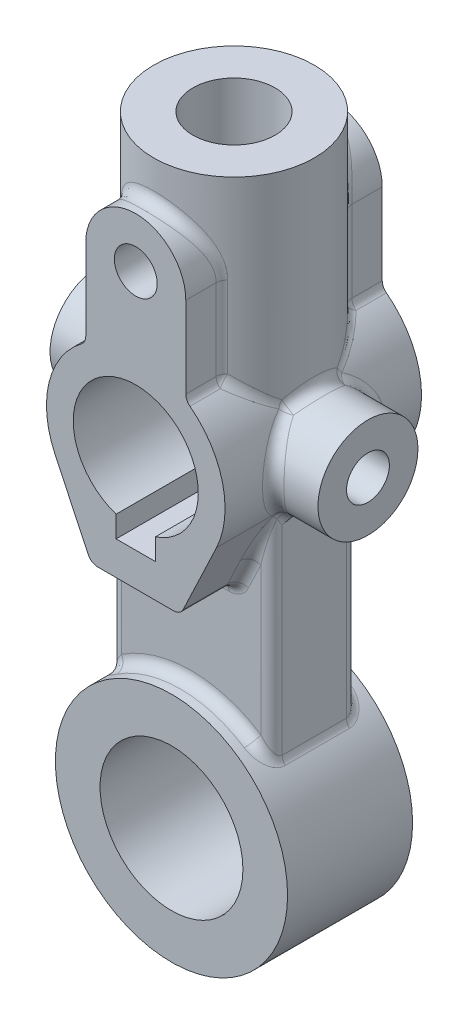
SolidWorks part; units mm, degrees
ref_plane "Front Plane" through (0, 0, 0) normal (0, 0, 1) x (1, 0, 0)
ref_plane "Top Plane" through (0, 0, 0) normal (0, 1, 0) x (1, 0, 0)
ref_plane "Right Plane" through (0, 0, 0) normal (1, 0, 0) x (0, 0, -1)
sketch "Sketch1" plane through (0, 0, 0) normal (0, 0, 1) x (1, 0, 0)
  line L0 (0, 0) -> (0, -32) construction
  line L1 (-12.5, -32) -> (12.5, -32)
  line L2 (12.5, -32) -> (22.5914, -10.7065)
  line L3 (-12.5, -32) -> (-22.5914, -10.7065)
  line L4 (14, 45) -> (14, 20.7123)
  line L5 (-14, 45) -> (-14, 20.7123)
  arc A0 (-14, 20.7123) -> (-22.5914, -10.7065) centre (0, 0) ccw
  arc A1 (-14, 45) -> (14, 45) centre (0, 45) cw
  arc A2 (22.5914, -10.7065) -> (14, 20.7123) centre (0, 0) ccw
  dimension "D1" = 14
  dimension "D3" = 25
  dimension "D4" = 45
  dimension "D2" = 25
  dimension "D5" = 32
extrude "Extrude1" add sketch "Sketch1" along normal mid plane 55
sketch "Sketch2" plane through (0, 0, 0) normal (0, 1, 0) x (1, 0, 0)
  circle A0 centre (0, 0) radius 22.5
  dimension "D1" = 45
extrude "Extrude2" add sketch "Sketch2" along normal blind 70
sketch "Sketch3" plane through (0, 0, 0) normal (0, 1, 0) x (1, 0, 0)
  line L0 (22.5, 12) -> (-22.5, -12) construction
  line L1 (-22.5, 12) -> (22.5, 12)
  line L2 (-22.5, 12) -> (-22.5, -12)
  line L3 (-22.5, -12) -> (22.5, -12)
  line L4 (22.5, 12) -> (22.5, -12)
  circle A0 centre (0, 0) radius 22.5 construction
  dimension "D1" = 24
extrude "Extrude3" add sketch "Sketch3" against normal blind 95
sketch "Sketch4" plane through (0, 0, 0) normal (0, 0, 1) x (1, 0, 0)
  line L0 (-22.5, -95) -> (22.5, -95) construction
  circle A0 centre (0, -95) radius 32.5
  dimension "D1" = 65
extrude "Extrude4" add sketch "Sketch4" along normal mid plane 35
sketch "Sketch5" plane through (0, 0, 0) normal (1, 0, 0) x (0, 0, -1)
  circle A0 centre (0, 0) radius 14
  dimension "D1" = 28
extrude "Extrude5" add sketch "Sketch5" along normal mid plane 75
sketch "Sketch6" plane through (0, 0, 0) normal (0, 0, 1) x (1, 0, 0)
  line L0 (0, 0) -> (0, -22.6132) construction
  line L1 (-5.5, -22.6132) -> (5.5, -22.6132)
  line L2 (5.5, -22.6132) -> (5.5, -16.6132)
  line L3 (-5.5, -22.6132) -> (-5.5, -16.6132)
  arc A0 (5.5, -16.6132) -> (-5.5, -16.6132) centre (0, 0) ccw
  dimension "D1" = 35
  dimension "D2" = 11
  dimension "D3" = 6
extrude "Cut-Extrude1" cut sketch "Sketch6" against normal through all and the other way through all
sketch "Sketch7" plane through (0, 0, 0) normal (0, 0, 1) x (1, 0, 0)
  circle A0 centre (0, 45) radius 6
  dimension "D1" = 12
extrude "Cut-Extrude2" cut sketch "Sketch7" against normal through all and the other way through all
sketch "Sketch8" plane through (0, 0, 0) normal (1, 0, 0) x (0, 0, -1)
  circle A0 centre (0, 0) radius 6
  dimension "D1" = 12
extrude "Cut-Extrude3" cut sketch "Sketch8" against normal through all and the other way through all
sketch "Sketch9" plane through (0, 70, 0) normal (0, 1, 0) x (-1, 0, 0)
  circle A0 centre (0, 0) radius 11.5
  dimension "D1" = 23
extrude "Cut-Extrude4" cut sketch "Sketch9" against normal blind 70
sketch "Sketch10" plane through (0, 0, 0) normal (0, 0, 1) x (1, 0, 0)
  circle A0 centre (0, -95) radius 20
  dimension "D1" = 40
extrude "Cut-Extrude5" cut sketch "Sketch10" against normal through all and the other way through all
fillet "Fillet1" radius 3 8 edges at (12.5, -32, 19.75) (-12.5, -32, 19.75) (-12.5, -32, -19.75) (12.5, -32, -19.75) (-22.5, -41.2236, -12) (22.5, -41.2236, -12) (22.5, -41.2236, 12) (-22.5, -41.2236, 12)
fillet "Fillet2" radius 3 4 edges at (-14, 20.7123, 22.557) (-14, 20.7123, -22.557) (14, 20.7123, 22.557) (14, 20.7123, -22.557)
fillet "Fillet3" radius 3 36 edges at (14.156, 21.2938, -17.4888) (14, 33.6243, -17.6139) (-14.4347, 20.6932, -17.2595) (-14, 33.6243, -17.6139) (-14.156, 21.2938, 17.4888) (-14, 33.6243, 17.6139) (14.4347, 20.6932, 17.2595) (14, 33.6243, 17.6139) (21.6213, -12.7534, -11.1213) (16.4064, -23.7572, -12) (12.2059, -31.5352, -12) (-21.6213, -12.7534, -11.1213) (-16.4064, -23.7572, -12) (-12.2059, -31.5352, -12) (-21.6213, -12.7534, 11.1213) (-16.4064, -23.7572, 12) (-12.2059, -31.5352, 12) (21.6213, -12.7534, 11.1213) (16.4064, -23.7572, 12) (12.2059, -31.5352, 12) (-21.741, -70.8426, 10.9945) (-22.5, -71.5479, 0) (-22.0944, -71.1654, -10.5064) (0, -62.5, -12) (21.741, -70.8426, -10.9945) (22.5, -71.5479, 0) (22.0944, -71.1654, 10.5064) (0.5692, 31.0116, 22.4928) (0.5692, 58.9884, -22.4928) (0, -32, -12) (0, -32, 12) (0, -62.5, 12)
fillet "Fillet4" radius 3 14 edges at (24.9996, 0.1361, -13.9993) (21.7683, 12.6746, -5.946) (22.4928, 13.9884, -0.5692) (21.7636, 12.4417, 6.4191) (-24.9996, -0.1361, -13.9993) (-21.7798, 12.3503, -6.5932) (-22.496, 13.9935, -0.425) (-21.7683, 12.6746, 5.946) (24.9996, 0.1361, -13.9993) (-24.9996, -0.1361, -13.9993)
